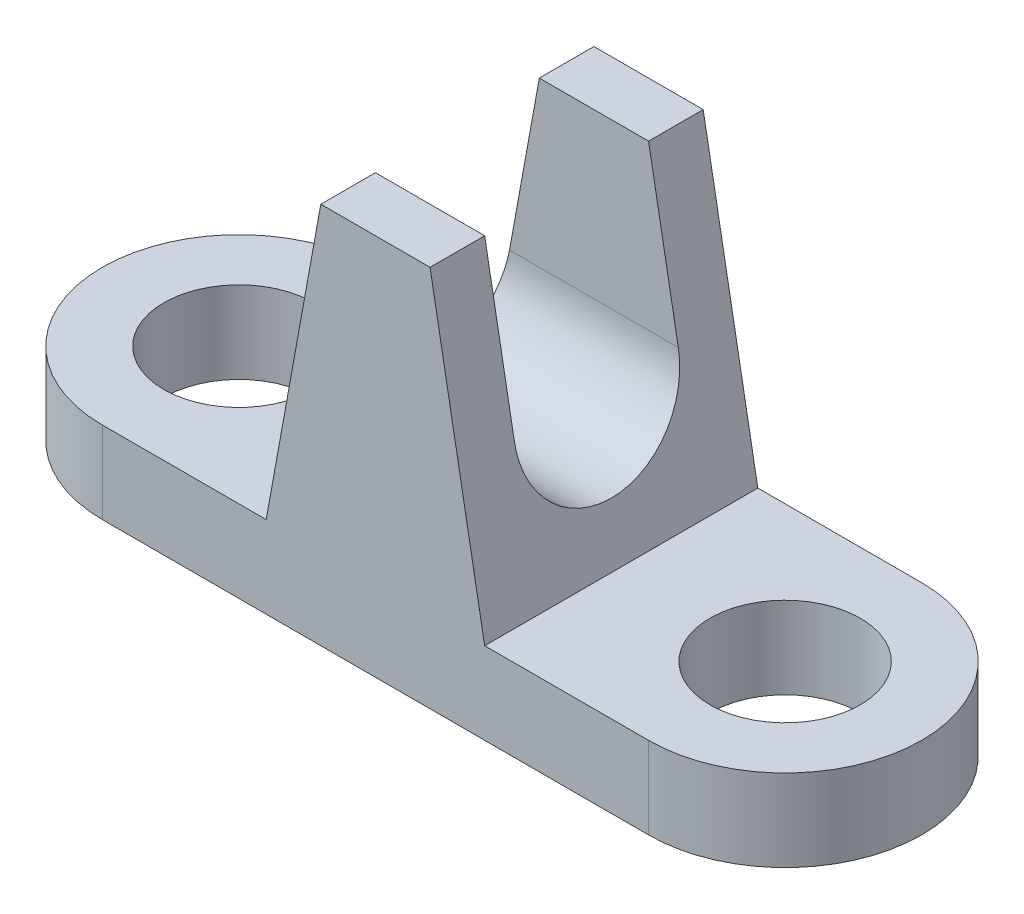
SolidWorks part; units mm, degrees
ref_plane "Front Plane" through (0, 0, 0) normal (0, 0, 1) x (1, 0, 0)
ref_plane "Top Plane" through (0, 0, 0) normal (0, 1, 0) x (1, 0, 0)
ref_plane "Right Plane" through (0, 0, 0) normal (1, 0, 0) x (0, 0, -1)
sketch "Sketch1" plane through (0, 0, 0) normal (0, 1, 0) x (1, 0, 0)
  line L0 (-55, 0) -> (55, 0) construction
  line L1 (-40, -20) -> (40, -20)
  line L2 (0, -55) -> (0, 55) construction
  line L3 (-40, 20) -> (40, 20)
  arc A0 (-40, 20) -> (-40, -20) centre (-40, 0) ccw
  arc A1 (40, -20) -> (40, 20) centre (40, 0) ccw
  circle A2 centre (-40, 0) radius 11
  circle A3 centre (40, 0) radius 11
  dimension "D4" = 22
  dimension "D1" = 40
  dimension "D2" = 40
  dimension "D3" = 40
extrude "Extrude1" add sketch "Sketch1" along normal blind 12
sketch "Sketch2" plane through (0, 0, 0) normal (0, 0, 1) x (1, 0, 0)
  line L0 (-16, 12) -> (16, 12)
  line L1 (-40, 12) -> (40, 12) construction
  line L2 (16, 12) -> (8, 56)
  line L3 (8, 56) -> (-8, 56)
  line L4 (-8, 56) -> (-16, 12)
  line L5 (0, -6.6) -> (0, 6.6) construction
  dimension "D1" = 16
  dimension "D2" = 16
  dimension "D3" = 8
  dimension "D4" = 16
  dimension "D5" = 44
extrude "Extrude2" add sketch "Sketch2" along normal mid plane 40
sketch "Sketch3" plane through (0, 0, 0) normal (1, 0, 0) x (0, 0, -1)
  line L0 (-12, 56) -> (12, 56)
  line L1 (12, 56) -> (12, 32)
  line L2 (-12, 32) -> (-12, 56)
  line L3 (-20, 56) -> (20, 56) construction
  line L4 (0, 30.8) -> (0, -30.8) construction
  arc A0 (12, 32) -> (-12, 32) centre (0, 32) cw
  dimension "D1" = 12
  dimension "D2" = 24
  dimension "D3" = 24
extrude "Cut-Extrude1" cut sketch "Sketch3" against normal mid plane 40
